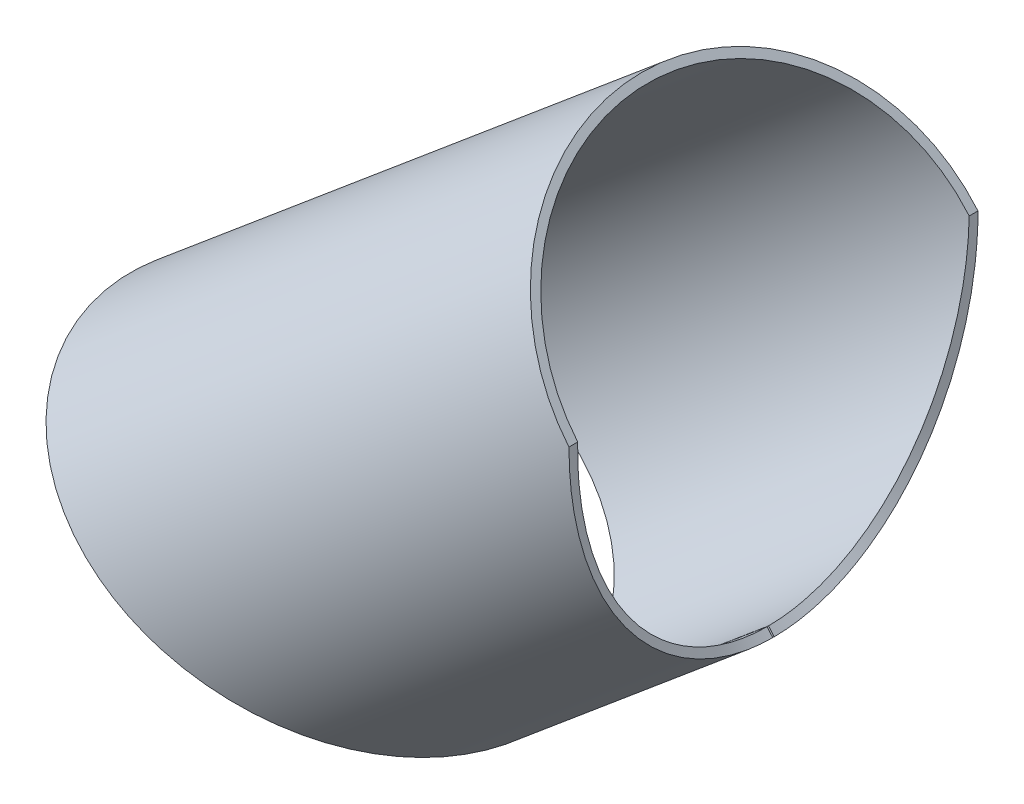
SolidWorks part; units mm, degrees
ref_plane "前视基准面" through (0, 0, 0) normal (0, 0, 1) x (1, 0, 0)
ref_plane "上视基准面" through (0, 0, 0) normal (0, 1, 0) x (1, 0, 0)
ref_plane "右视基准面" through (0, 0, 0) normal (1, 0, 0) x (0, 0, -1)
imported_body "基体零件-等径裤形管-1"
sheet metal parameters "钣金1" parameters "D1"=0.7366, "厚度"=6
bend "圆角折弯1" bend radius 134 bend angle 359.591 parameters "D5"=1
flatten bends "展开-折弯1"
sketch "尖角-草图1" plane through (-80.0004, -249.8842, -0.5) normal (0.6428, -0.766, -0.0036) x (0.766, 0.6428, 0.003)
  line L0 (103.1726, -420.8059) -> (-105.6928, -420.18) construction
  dimension "D1" = 0
process bends "加工-折弯1" parameters "D1"=0
sketch "平面-草图1" plane through (-80.0004, -249.8842, -0.5) normal (0.6428, -0.766, -0.0036) x (0.766, 0.6428, 0.003)
